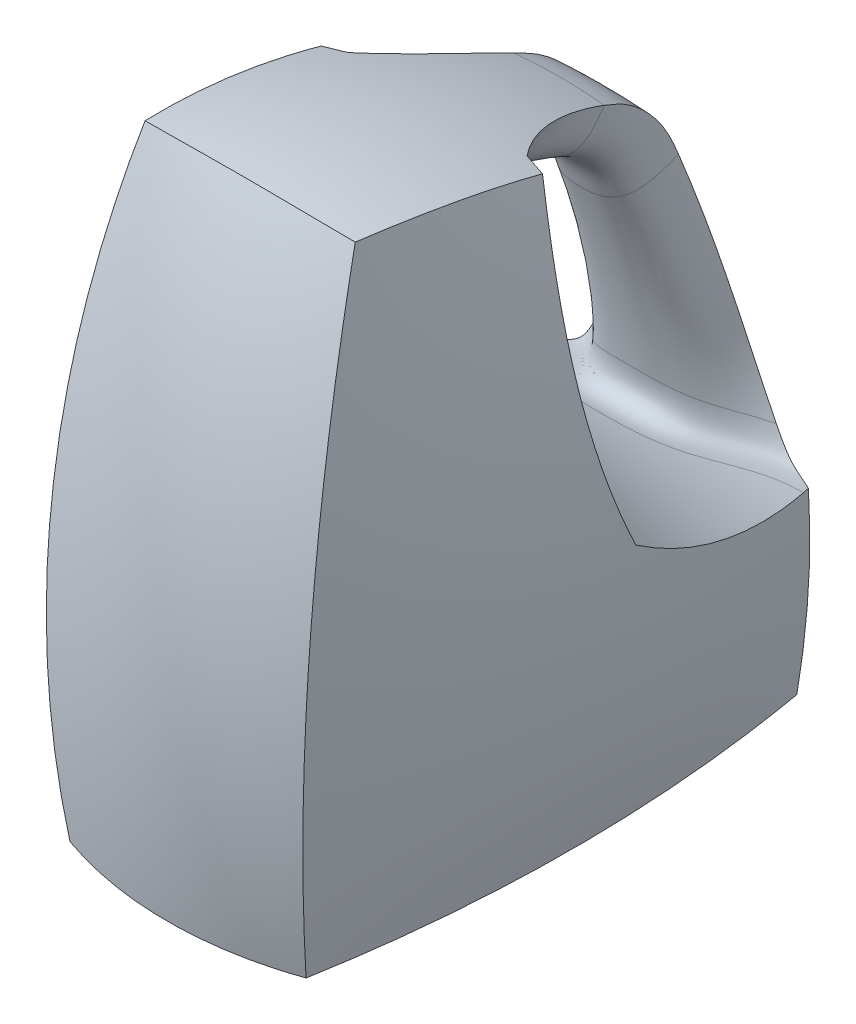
SolidWorks part; units mm, degrees
ref_plane "Front Plane" through (0, 0, 0) normal (0, 0, 1) x (1, 0, 0)
ref_plane "Top Plane" through (0, 0, 0) normal (0, 1, 0) x (1, 0, 0)
ref_plane "Right Plane" through (0, 0, 0) normal (1, 0, 0) x (0, 0, -1)
sketch "Esquisse Top view" plane through (0, 0, 0) normal (0, 1, 0) x (1, 0, 0)
  line L1 (-50.8, -105.5841) -> (50.8, -105.5841) construction
  line L2 (-50.8, -105.5841) -> (-50.8, 105.5841) construction
  line L3 (-50.8, 105.5841) -> (50.8, 105.5841) construction
  line L4 (50.8, -105.5841) -> (50.8, 105.5841) construction
  line L5 (-50.8, -105.5841) -> (50.8, 105.5841) construction
  line L6 (-50.8, 105.5841) -> (50.8, -105.5841) construction
  arc A8 (-50.8, -105.5841) -> (50.8, -105.5841) centre (0, 38.1) ccw
  arc A9 (50.8, -105.5841) -> (50.8, 105.5841) centre (-549.5867, 0) ccw
  arc A10 (50.8, 105.5841) -> (-50.8, 105.5841) centre (0, -38.1) ccw
  arc A11 (-50.8, 105.5841) -> (-50.8, -105.5841) centre (549.5867, 0) ccw
  point P0 (0, 0)
  dimension "D3" = 120.0267
  dimension "D4" = 228.6
  dimension "D1" = 101.6
  dimension "D2" = 211.1682
sketch "Esquisse Side view" plane through (0, 0, 0) normal (1, 0, 0) x (0, 0, -1)
  line L0 (-114.3, 0) -> (114.3, 0)
  line L1 (0, 0) -> (0, 240.03) construction
  line L2 (-82.55, 262.1492) -> (76.2, 219.6123) construction
  line L3 (-114.3, 0) -> (-145.2195, 175.3534) construction
  line L4 (114.3, 0) -> (131.0673, 191.6507) construction
  line L5 (35, 217.0412) -> (42.6114, 235.5363)
  line L6 (83.8817, 201.8704) -> (54.7039, 190)
  line L7 (113.1063, 87.63) -> (168.8482, 80.7857) construction
  arc A0 (-82.55, 262.1492) -> (76.2, 219.6123) centre (-92.7199, -93.3053) cw
  arc A1 (-82.55, 262.1492) -> (-114.3, 0) centre (332.8381, 78.8425) ccw
  arc A2 (76.2, 219.6123) -> (114.3, 0) centre (-319.1152, 37.9189) cw
  arc A3 (29.21, 119.38) -> (6.35, 248.2155) centre (259.4351, 226.676) cw
  arc A4 (29.21, 119.38) -> (113.1063, 87.63) centre (136.1379, 275.2077) ccw
  arc A5 (5.4368, 227.6193) -> (44.5249, 212.9482) centre (-92.7199, -93.3053) cw
  arc A6 (44.5249, 212.9482) -> (80.4538, 94.6111) centre (-319.1152, 37.9189) cw
  arc A7 (-60, 0) -> (-50, 259.7193) centre (723.6608, 99.8788) cw
  line B0 (-72.35, 252.3463) -> (-72.35, 266.3686)
  line B1 (-72.35, 266.3686) -> (-69.81, 266.3686)
  line B2 (-69.81, 266.3686) -> (-69.81, 253.6686)
  line B3 (-69.81, 253.6686) -> (-66, 251.0008)
  line B4 (-66, 251.0008) -> (-66, 286)
  line B5 (-66, 286) -> (-63.46, 286)
  line B6 (-63.46, 286) -> (-63.46, 241.55)
  line B7 (-63.46, 241.55) -> (-66, 241.55)
  line B8 (-66, 241.55) -> (-66, 247.9)
  line B9 (-66, 247.9) -> (-72.35, 252.3463)
  line B10 (-69.81, 253.6686) -> (-71.2669, 251.5879) construction
  line B11 (-45, 295.5425) -> (-45, 239.9796) construction
  dimension "D8" = 355.6
  dimension "D12" = 254
  dimension "D15" = 20
  dimension "D14" = 31.5
  dimension "D20" = 790
  dimension "D1" = 262.1492
  dimension "D2" = 87.63
  dimension "D3" = 105
  dimension "D4" = 100
  dimension "D5" = 95
  dimension "D6" = 76.2
  dimension "D7" = 82.55
  dimension "D9" = 29.21
  dimension "D10" = 119.38
  dimension "D11" = 7
  dimension "D13" = 6.35
  dimension "D16" = 190
  dimension "D17" = 35
  dimension "D18" = 60
  dimension "D19" = 50
  dimension "D21" = 286
  dimension "D22" = 45
sketch_block_instance "Bouchon-1"
sketch_block "Bouchon" parameters "D1"=2.54, "D2"=55, "D3"=6.35, "D4"=12.7, "D5"=6.35, "D6"=44.45, "D7"=38.1, "D8"=34.9992
sketch "Esquisse Front view" plane through (0, 0, 0) normal (0, 0, 1) x (1, 0, 0)
  line L0 (0, 0) -> (0, 115.033) construction
  line L1 (60.0133, 0) -> (50.8, 0) construction
  line L4 (60.0133, 0) -> (-60.0133, 0)
  line L5 (-18, 249.3553) -> (-18, 268.9295) construction
  arc A0 (-60.0133, 0) -> (-47.625, 245.4891) centre (412.2762, 99.2236) cw
  arc A1 (-47.625, 245.4891) -> (47.625, 245.4891) centre (0, -4.0061) cw
  arc A2 (60.0133, 0) -> (47.625, 245.4891) centre (-412.2762, 99.2236) ccw
  arc A3 (69.7154, 75) -> (-69.7154, 75) centre (0, -111.0936) ccw
  arc A4 (15, 249.5506) -> (23.4, 0) centre (-972.4145, 91.3971) cw
  arc A5 (-15, 249.5506) -> (-23.4, 0) centre (972.4145, 91.3971) ccw
  spline S0 degree 2 poles (-18, 249.3553) (-18, 124.3553) (-45, 82.4679) knots 0 0 0 1 1 1
  spline S1 degree 2 poles (18, 249.3553) (18, 124.3553) (45, 82.4679) knots 0 0 0 1 1 1
  point P15 (0, 249.9939)
  dimension "D2" = 482.6
  dimension "D3" = 254
  dimension "D7" = 250
  dimension "D8" = 1000
  dimension "D1" = 95.25
  dimension "D4" = 75
  dimension "D5" = 18
  dimension "D6" = 45
  dimension "D9" = 23.4
  dimension "D10" = 15
sketch "Esquisse1" [suppressed] plane through (0, 0, 0) normal (1, 0, 0) x (0, 0, -1)
  arc A0 (-82.55, 262.1492) -> (-114.3, 0) centre (332.8381, 78.8425) ccw construction
  arc A1 (-82.55, 262.1492) -> (-114.3, 0) centre (332.8381, 78.8425) ccw
sketch "Esquisse2" [suppressed] plane through (0, 0, 0) normal (0, 1, 0) x (1, 0, 0)
  arc A0 (-50.8, -105.5841) -> (50.8, -105.5841) centre (0, 38.1) ccw construction
  arc A1 (-50.8, -105.5841) -> (50.8, -105.5841) centre (0, 38.1) ccw
surface "Surface-Balayage2" [suppressed]
sketch "Esquisse6" [suppressed] plane through (0, 0, 0) normal (0, 0, 1) x (1, 0, 0)
  arc A0 (60.0133, 0) -> (47.625, 245.4891) centre (-412.2762, 99.2236) ccw construction
  arc A1 (60.0133, 0) -> (47.625, 245.4891) centre (-412.2762, 99.2236) ccw
sketch "Esquisse7" [suppressed] plane through (0, 0, 0) normal (0, 1, 0) x (1, 0, 0)
  arc A0 (50.8, -105.5841) -> (50.8, 105.5841) centre (-549.5867, 0) ccw construction
  arc A1 (50.8, -105.5841) -> (50.8, 105.5841) centre (-549.5867, 0) ccw
surface "Surface-Balayage4" [suppressed]
surface "Surface-Prolonger1" [suppressed] parameters "D1"=50, "D2"=50
surface "Surface-Prolonger2" [suppressed] parameters "D1"=50, "D2"=50
mirror "Symétrie1" [suppressed] about plane through (0, 0, 0) normal (1, 0, 0)
mirror "Symétrie2" [suppressed] about plane through (0, 0, 0) normal (0, 0, 1)
surface "Surface-Restreindre1" [suppressed]
sketch "Esquisse8" [suppressed] plane through (0, 0, 0) normal (0, 1, 0) x (1, 0, 0)
  line L1 (-95.1294, -139.2638) -> (95.1294, -139.2638)
  line L2 (-95.1294, -139.2638) -> (-95.1294, 139.2638)
  line L3 (-95.1294, 139.2638) -> (95.1294, 139.2638)
  line L4 (95.1294, -139.2638) -> (95.1294, 139.2638)
  line L5 (-95.1294, -139.2638) -> (95.1294, 139.2638) construction
  line L6 (-95.1294, 139.2638) -> (95.1294, -139.2638) construction
  point P0 (0, 0)
surface "Surface-Plan2" [suppressed] sketch "Esquisse8"
surface "Surface-Prolonger3" [suppressed] parameters "D1"=50, "D2"=50, "D3"=50, "D4"=50
surface "Surface-Restreindre3" [suppressed]
sketch "Esquisse9" plane through (0, 0, 0) normal (1, 0, 0) x (0, 0, -1)
  arc A0 (-82.55, 262.1492) -> (-114.3, 0) centre (332.8381, 78.8425) ccw construction
  arc A1 (114.3, 0) -> (76.2, 219.6123) centre (-319.1152, 37.9189) ccw construction
  arc A2 (-82.55, 262.1492) -> (-114.3, 0) centre (332.8381, 78.8425) ccw
  arc A3 (114.3, 0) -> (76.2, 219.6123) centre (-319.1152, 37.9189) ccw
sketch "Esquisse11" plane through (0, 0, 0) normal (0, 0, 1) x (1, 0, 0)
  arc A0 (-47.625, 245.4891) -> (-60.0133, 0) centre (412.2762, 99.2236) ccw construction
  arc A1 (60.0133, 0) -> (47.625, 245.4891) centre (-412.2762, 99.2236) ccw construction
  arc A2 (-47.625, 245.4891) -> (-60.0133, 0) centre (412.2762, 99.2236) ccw
  arc A3 (60.0133, 0) -> (47.625, 245.4891) centre (-412.2762, 99.2236) ccw
sketch "Esquisse12" plane through (0, 0, 0) normal (0, 1, 0) x (1, 0, 0)
  arc A4 (-50.8, -105.5841) -> (50.8, -105.5841) centre (0, 38.1) ccw
  arc A5 (50.8, -105.5841) -> (50.8, 105.5841) centre (-549.5867, 0) ccw
  arc A6 (50.8, 105.5841) -> (-50.8, 105.5841) centre (0, -38.1) ccw
  arc A7 (-50.8, 105.5841) -> (-50.8, -105.5841) centre (549.5867, 0) ccw
  arc A8 (-50.8, -105.5841) -> (50.8, -105.5841) centre (0, 38.1) ccw
  arc A9 (50.8, -105.5841) -> (50.8, 105.5841) centre (-549.5867, 0) ccw
  arc A10 (50.8, 105.5841) -> (-50.8, 105.5841) centre (0, -38.1) ccw
  arc A11 (-50.8, 105.5841) -> (-50.8, -105.5841) centre (549.5867, 0) ccw
  dimension "D1" = 0
other "Frontière1"
sketch "Esquisse13" plane through (0, 0, 0) normal (0, 0, 1) x (1, 0, 0)
  arc A0 (47.625, 245.4891) -> (-47.625, 245.4891) centre (0, -4.0061) ccw construction
  arc A1 (47.625, 245.4891) -> (-47.625, 245.4891) centre (0, -4.0061) ccw
sketch "Esquisse14" plane through (0, 0, 0) normal (1, 0, 0) x (0, 0, -1)
  arc A0 (76.2, 219.6123) -> (-82.55, 262.1492) centre (-92.7199, -93.3053) ccw construction
  arc A1 (76.2, 219.6123) -> (-82.55, 262.1492) centre (-92.7199, -93.3053) ccw
surface "Surface-Balayage5"
other "Remplacer la face1"
delete or keep bodies "Corps-Supprimer/Garder 1" type delete bodies bodies 264
sketch "Esquisse15" plane through (0, 0, 0) normal (1, 0, 0) x (0, 0, -1)
  arc A0 (29.21, 119.38) -> (113.1063, 87.63) centre (136.1379, 275.2077) ccw construction
  arc A1 (6.35, 248.2155) -> (29.21, 119.38) centre (259.4351, 226.676) ccw construction
  arc A2 (29.21, 119.38) -> (113.1063, 87.63) centre (136.1379, 275.2077) ccw
  arc A3 (6.35, 248.2155) -> (29.21, 119.38) centre (259.4351, 226.676) ccw
  point P5 (0, 0)
ref_plane "Plan1" through (0, 87.63, -113.1063) normal (0, -0.1219, -0.9925) x (-1, 0, 0)
sketch "Esquisse16" plane through (0, 87.63, -113.1063) normal (0, -0.1219, -0.9925) x (-1, 0, 0)
  line L0 (-80, -20) -> (80, -20) construction
  arc A0 (-80, -20) -> (80, -20) centre (0, -170) cw
  point P3 (0, 0)
  dimension "D1" = 160
  dimension "D2" = 20
surface "Surface-Balayage6"
surface "Surface-Décalage1" parameters "D1"=0
surface "Surface-Décalage2" parameters "D1"=0
surface "Surface-Restreindre4"
other "Enlèv. mat.-Surface1"
delete or keep bodies "Corps-Supprimer/Garder 2" type delete bodies bodies 265
sketch "Esquisse17" plane through (0, 0, 0) normal (0, 0, 1) x (1, 0, 0)
  parabola Q0 construction
  parabola Q1 construction
  parabola Q2
  parabola Q3
  spline S0 degree 3 poles (50.8, 0) (52.82, 18.9272) (54.7638, 45.3949) (55.4907, 71.8291) (55.5988, 79.2096) knots 0 0 0 0 0.25 0.347052 0.347052 0.347052 0.347052 construction
  spline S1 degree 3 poles (-50.8, 0) (-52.82, 18.9272) (-54.7638, 45.3949) (-55.4907, 71.8291) (-55.5988, 79.2096) knots 0 0 0 0 0.25 0.347052 0.347052 0.347052 0.347052 construction
  point P12 (55.4216, 70.2754)
  point P16 (-55.4205, 70.2295)
surface "Surface-Restreindre5"
sketch "Esquisse18" plane through (0, 0, 0) normal (0, 1, 0) x (1, 0, 0)
  line L0 (18.4433, 47.7037) -> (18.4433, 105.3844) construction
  line L1 (0, 0) -> (0, 88.9385) construction
  line L2 (18.4433, 76.544) -> (18.4433, 102.0866)
  line L3 (-18.4433, 76.544) -> (-18.4433, 102.0866)
  line L4 (38.5, 1.7849) -> (44.4918, -5.3558)
  line L5 (-38.5, 1.7849) -> (-45.2247, -6.2292)
  spline S0 degree 3 poles (18.4433, 76.544) (18.4433, 43.2107) (24.8457, 18.0575) (38.5, 1.7849) knots 0 0 0 0 1 1 1 1
  spline S1 degree 3 poles (47.6315, -0.6812) (43.7706, 0.4794) (39.8735, 1.4995) (32.0065, 3.256) (28.0349, 3.9927) (16.0185, 5.7667) (7.9578, 6.3575) (-8.2639, 6.3424) (-16.2733, 5.7368) (-32.0982, 3.3851) (-39.9137, 1.6389) (-47.6315, -0.6812) knots 0 0 0 0 0.125 0.125 0.25 0.25 0.5 0.5 0.75 0.75 1 1 1 1 construction
  spline S2 degree 3 poles (-18.4433, 76.544) (-18.4433, 43.2107) (-24.8457, 18.0575) (-38.5, 1.7849) knots 0 0 0 0 1 1 1 1
  dimension "D2" = 100
  dimension "D1" = 38.5
  dimension "D3" = 40
surface "Surface-Restreindre6"
ref_plane "Plan2" through (0, 150.3131, 70.0921) normal (0, 0.9063, 0.4226) x (-1, 0, 0)
sketch "Esquisse19" plane through (0, 150.3131, 70.0921) normal (0, 0.9063, 0.4226) x (-1, 0, 0)
  line L0 (-18.4433, -161.7951) -> (18.4433, -161.7951) construction
  line L1 (0, -161.7951) -> (0, -136.7951) construction
  line L2 (8.6449, -136.7951) -> (-8.6449, -136.7951) construction
  line L3 (-18.4433, -161.7951) -> (-18.4433, -166.8211) construction
  spline S0 degree 3 poles (-18.4433, -161.7951) (-18.4433, -141.1284) (-13.3333, -136.7951) (0, -136.7951) knots 0 0 0 0 1 1 1 1
  spline S1 degree 3 poles (18.4433, -161.7951) (18.4433, -141.1284) (13.3333, -136.7951) (0, -136.7951) knots 0 0 0 0 1 1 1 1
  point P9 (-19.6962, -166.6624)
  dimension "D3" = 62
  dimension "D4" = 40
  dimension "D1" = 25
  dimension "D2" = 90
other "Surface frontière1"
ref_plane "Plan3" through (0, 27.0128, 43.2296) normal (0, 0.5299, 0.848) x (-1, 0, 0)
sketch "Esquisse20" plane through (0, 27.0128, 43.2296) normal (0, 0.5299, 0.848) x (-1, 0, 0)
  line L0 (18.4433, -226.0224) -> (-18.4433, -226.0224) construction
  line L1 (0, -226.0224) -> (0, -203.0224) construction
  line L2 (18.4433, -214.9153) -> (18.4433, -237.1294) construction
  line L3 (-10.4668, -203.0224) -> (10.4668, -203.0224) construction
  spline S0 degree 3 poles (18.4433, -226.0224) (18.4433, -211.7894) (16.6715, -203.0224) (0, -203.0224) knots 0 0 0 0 1 1 1 1
  spline S1 degree 3 poles (-18.4433, -226.0224) (-18.4433, -211.7894) (-16.6715, -203.0224) (0, -203.0224) knots 0 0 0 0 1 1 1 1
  dimension "D1" = 23
other "Surface frontière2"
ref_plane "Plan4" through (0, 127.6554, 59.5267) normal (0, 0.9063, 0.4226) x (-1, 0, 0)
surface "Surface-Restreindre7"
ref_plane "Plan5" through (0, 40.2608, 64.4308) normal (0, 0.5299, 0.848) x (-1, 0, 0)
surface "Surface-Restreindre8"
other "Surface frontière3"
other "Surface frontière4"
surface "Surface-Cousue1"
surface "Surface-Prolonger4" parameters "D1"=2
other "SupprimerFace1"
surface "Surface-Restreindre9"
fillet "Congé2" radius 17 5 edges at (-26.4887, 135.3094, -103.4857) (-10.7843, 92.6023, -86.1367) (-61.9941, 82.9166, -78.6799)
other "Intersect1"
